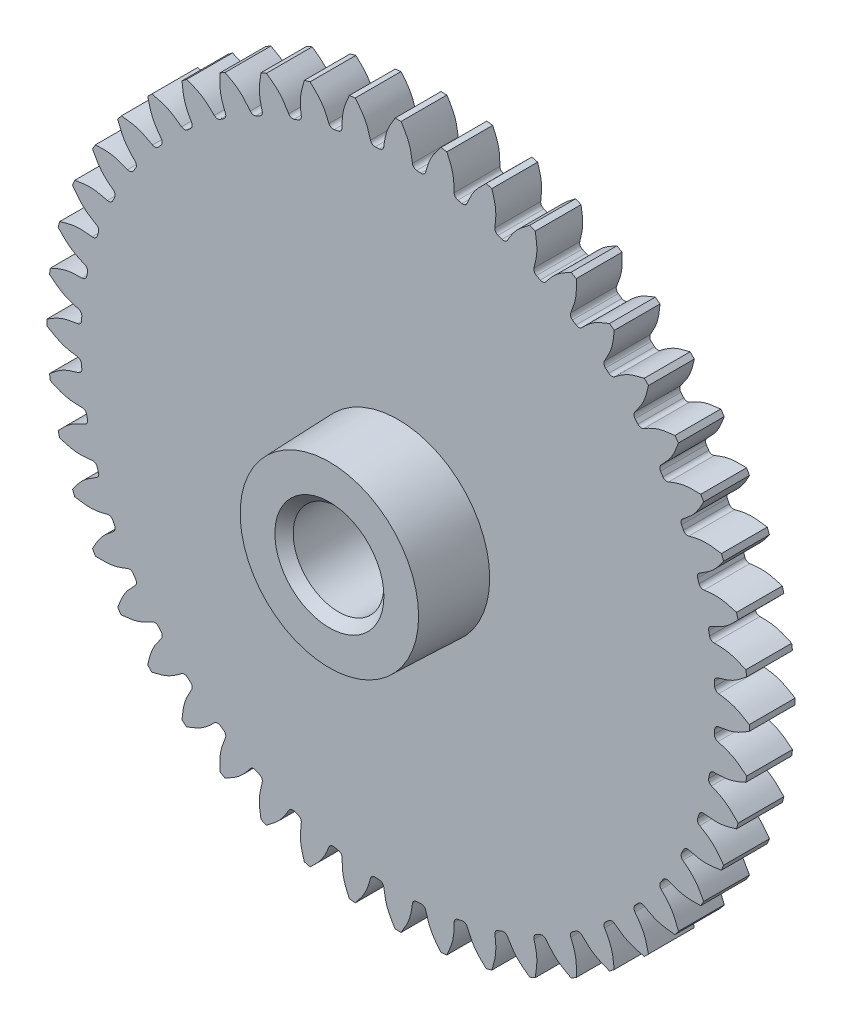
SolidWorks part; units mm, degrees
ref_plane "Face" through (0, 0, 0) normal (0, 0, 1) x (1, 0, 0)
ref_plane "Dessus" through (0, 0, 0) normal (0, 1, 0) x (1, 0, 0)
ref_plane "Droite" through (0, 0, 0) normal (1, 0, 0) x (0, 0, -1)
sketch "Esquisse1" plane through (0, 0, 0) normal (0, 0, 1) x (1, 0, 0)
  line L0 (0, 12.1501) -> (0, -6.105) construction
  line L1 (0.72, 12.0433) -> (0.72, 10.002) construction
  line L2 (0.36, 11.5985) -> (0.36, 10.9941) construction
  line L3 (-0.9735, 14.6577) -> (0.8316, 9.6984) construction
  line L4 (0, 11.5) -> (0.8727, 11.5) construction
  line L5 (0.0972, 11.5) -> (-0.0972, 11.5)
  line L6 (1.5974, 11.3889) -> (1.4047, 11.4143)
  line L7 (1.9563, 10.1988) -> (2.0955, 10.1711)
  line L8 (0.6084, 10.3669) -> (0.75, 10.3576)
  line L9 (3.0703, 11.083) -> (2.8825, 11.1333)
  line L10 (3.2708, 9.8562) -> (3.4052, 9.8106)
  line L11 (4.4907, 10.5874) -> (4.311, 10.6618)
  line L12 (4.5293, 9.3449) -> (4.6566, 9.2822)
  line L13 (5.8342, 9.9107) -> (5.6658, 10.0079)
  line L14 (5.7103, 8.6738) -> (5.8283, 8.5949)
  line L15 (7.0779, 9.0644) -> (6.9236, 9.1827)
  line L16 (6.7936, 7.8542) -> (6.9003, 7.7607)
  line L17 (8.2005, 8.063) -> (8.063, 8.2005)
  line L18 (7.7607, 6.9003) -> (7.8542, 6.7936)
  line L19 (9.1827, 6.9236) -> (9.0644, 7.0779)
  line L20 (8.5949, 5.8283) -> (8.6738, 5.7103)
  line L21 (10.0079, 5.6658) -> (9.9107, 5.8342)
  line L22 (9.2822, 4.6566) -> (9.3449, 4.5293)
  line L23 (10.6618, 4.311) -> (10.5874, 4.4907)
  line L24 (9.8106, 3.4052) -> (9.8562, 3.2708)
  line L25 (11.1333, 2.8825) -> (11.083, 3.0703)
  line L26 (10.1711, 2.0955) -> (10.1988, 1.9563)
  line L27 (11.4143, 1.4047) -> (11.3889, 1.5974)
  line L28 (10.3576, 0.75) -> (10.3669, 0.6084)
  line L29 (11.5, -0.0972) -> (11.5, 0.0972)
  line L30 (10.3669, -0.6084) -> (10.3576, -0.75)
  line L31 (11.3889, -1.5974) -> (11.4143, -1.4047)
  line L32 (10.1988, -1.9563) -> (10.1711, -2.0955)
  line L33 (11.083, -3.0703) -> (11.1333, -2.8825)
  line L34 (9.8562, -3.2708) -> (9.8106, -3.4052)
  line L35 (10.5874, -4.4907) -> (10.6618, -4.311)
  line L36 (9.3449, -4.5293) -> (9.2822, -4.6566)
  line L37 (9.9107, -5.8342) -> (10.0079, -5.6658)
  line L38 (8.6738, -5.7103) -> (8.5949, -5.8283)
  line L39 (9.0644, -7.0779) -> (9.1827, -6.9236)
  line L40 (7.8542, -6.7936) -> (7.7607, -6.9003)
  line L41 (8.063, -8.2005) -> (8.2005, -8.063)
  line L42 (6.9003, -7.7607) -> (6.7936, -7.8542)
  line L43 (6.9236, -9.1827) -> (7.0779, -9.0644)
  line L44 (5.8283, -8.5949) -> (5.7103, -8.6738)
  line L45 (5.6658, -10.0079) -> (5.8342, -9.9107)
  line L46 (4.6566, -9.2822) -> (4.5293, -9.3449)
  line L47 (4.311, -10.6618) -> (4.4907, -10.5874)
  line L48 (3.4052, -9.8106) -> (3.2708, -9.8562)
  line L49 (2.8825, -11.1333) -> (3.0703, -11.083)
  line L50 (2.0955, -10.1711) -> (1.9563, -10.1988)
  line L51 (1.4047, -11.4143) -> (1.5974, -11.3889)
  line L52 (0.75, -10.3576) -> (0.6084, -10.3669)
  line L53 (-0.0972, -11.5) -> (0.0972, -11.5)
  line L54 (-0.6084, -10.3669) -> (-0.75, -10.3576)
  line L55 (-1.5974, -11.3889) -> (-1.4047, -11.4143)
  line L56 (-1.9563, -10.1988) -> (-2.0955, -10.1711)
  line L57 (-3.0703, -11.083) -> (-2.8825, -11.1333)
  line L58 (-3.2708, -9.8562) -> (-3.4052, -9.8106)
  line L59 (-4.4907, -10.5874) -> (-4.311, -10.6618)
  line L60 (-4.5293, -9.3449) -> (-4.6566, -9.2822)
  line L61 (-5.8342, -9.9107) -> (-5.6658, -10.0079)
  line L62 (-5.7103, -8.6738) -> (-5.8283, -8.5949)
  line L63 (-7.0779, -9.0644) -> (-6.9236, -9.1827)
  line L64 (-6.7936, -7.8542) -> (-6.9003, -7.7607)
  line L65 (-8.2005, -8.063) -> (-8.063, -8.2005)
  line L66 (-7.7607, -6.9003) -> (-7.8542, -6.7936)
  line L67 (-9.1827, -6.9236) -> (-9.0644, -7.0779)
  line L68 (-8.5949, -5.8283) -> (-8.6738, -5.7103)
  line L69 (-10.0079, -5.6658) -> (-9.9107, -5.8342)
  line L70 (-9.2822, -4.6566) -> (-9.3449, -4.5293)
  line L71 (-10.6618, -4.311) -> (-10.5874, -4.4907)
  line L72 (-9.8106, -3.4052) -> (-9.8562, -3.2708)
  line L73 (-11.1333, -2.8825) -> (-11.083, -3.0703)
  line L74 (-10.1711, -2.0955) -> (-10.1988, -1.9563)
  line L75 (-11.4143, -1.4047) -> (-11.3889, -1.5974)
  line L76 (-10.3576, -0.75) -> (-10.3669, -0.6084)
  line L77 (-11.5, 0.0972) -> (-11.5, -0.0972)
  line L78 (-10.3669, 0.6084) -> (-10.3576, 0.75)
  line L79 (-11.3889, 1.5974) -> (-11.4143, 1.4047)
  line L80 (-10.1988, 1.9563) -> (-10.1711, 2.0955)
  line L81 (-11.083, 3.0703) -> (-11.1333, 2.8825)
  line L82 (-9.8562, 3.2708) -> (-9.8106, 3.4052)
  line L83 (-10.5874, 4.4907) -> (-10.6618, 4.311)
  line L84 (-9.3449, 4.5293) -> (-9.2822, 4.6566)
  line L85 (-9.9107, 5.8342) -> (-10.0079, 5.6658)
  line L86 (-8.6738, 5.7103) -> (-8.5949, 5.8283)
  line L87 (-9.0644, 7.0779) -> (-9.1827, 6.9236)
  line L88 (-7.8542, 6.7936) -> (-7.7607, 6.9003)
  line L89 (-8.063, 8.2005) -> (-8.2005, 8.063)
  line L90 (-6.9003, 7.7607) -> (-6.7936, 7.8542)
  line L91 (-6.9236, 9.1827) -> (-7.0779, 9.0644)
  line L92 (-5.8283, 8.5949) -> (-5.7103, 8.6738)
  line L93 (-5.6658, 10.0079) -> (-5.8342, 9.9107)
  line L94 (-4.6566, 9.2822) -> (-4.5293, 9.3449)
  line L95 (-4.311, 10.6618) -> (-4.4907, 10.5874)
  line L96 (-3.4052, 9.8106) -> (-3.2708, 9.8562)
  line L97 (-2.8825, 11.1333) -> (-3.0703, 11.083)
  line L98 (-2.0955, 10.1711) -> (-1.9563, 10.1988)
  line L99 (-1.4047, 11.4143) -> (-1.5974, 11.3889)
  line L100 (-0.75, 10.3576) -> (-0.6084, 10.3669)
  circle A0 centre (0, 0) radius 10.375 construction
  circle A1 centre (0, 0) radius 11 construction
  circle A2 centre (0, 0) radius 11.5 construction
  circle A3 centre (0, 0) radius 10.5 construction
  circle A4 centre (0, 0) radius 11.625 construction
  arc A5 (0.6084, 10.3669) -> (0.4694, 10.4975) centre (0.6182, 10.5166) cw
  arc A6 (0.75, 10.3576) -> (0.9048, 10.469) centre (0.7598, 10.5073) ccw
  arc A7 (-0.6084, 10.3669) -> (-0.4694, 10.4975) centre (-0.6182, 10.5166) ccw
  arc A8 (-0.75, 10.3576) -> (-0.9048, 10.469) centre (-0.7598, 10.5073) cw
  arc A9 (-1.8356, 10.3464) -> (-1.9563, 10.1988) centre (-1.9856, 10.3459) cw
  arc A10 (-2.0955, 10.1711) -> (-2.2636, 10.2613) centre (-2.1248, 10.3182) cw
  arc A11 (-3.1704, 10.0183) -> (-3.2708, 9.8562) centre (-3.319, 9.9982) cw
  arc A12 (-3.4052, 9.8106) -> (-3.5836, 9.8781) centre (-3.4534, 9.9526) cw
  arc A13 (-4.4509, 9.5188) -> (-4.5293, 9.3449) centre (-4.5956, 9.4795) cw
  arc A14 (-4.6566, 9.2822) -> (-4.8422, 9.3258) centre (-4.7229, 9.4167) cw
  arc A15 (-5.6553, 8.8564) -> (-5.7103, 8.6738) centre (-5.7936, 8.7985) cw
  arc A16 (-5.8283, 8.5949) -> (-6.0181, 8.614) centre (-5.9116, 8.7197) cw
  arc A17 (-6.7629, 8.0425) -> (-6.7936, 7.8542) centre (-6.8925, 7.967) cw
  arc A18 (-6.9003, 7.7607) -> (-7.0909, 7.7548) centre (-6.9992, 7.8734) cw
  arc A19 (-7.7548, 7.0909) -> (-7.7607, 6.9003) centre (-7.8734, 6.9992) cw
  arc A20 (-7.8542, 6.7936) -> (-8.0425, 6.7629) centre (-7.967, 6.8925) cw
  arc A21 (-8.614, 6.0181) -> (-8.5949, 5.8283) centre (-8.7197, 5.9116) cw
  arc A22 (-8.6738, 5.7103) -> (-8.8564, 5.6553) centre (-8.7985, 5.7936) cw
  arc A23 (-9.3258, 4.8422) -> (-9.2822, 4.6566) centre (-9.4167, 4.7229) cw
  arc A24 (-9.3449, 4.5293) -> (-9.5188, 4.4509) centre (-9.4795, 4.5956) cw
  arc A25 (-9.8781, 3.5836) -> (-9.8106, 3.4052) centre (-9.9526, 3.4534) cw
  arc A26 (-9.8562, 3.2708) -> (-10.0183, 3.1704) centre (-9.9982, 3.319) cw
  arc A27 (-10.2613, 2.2636) -> (-10.1711, 2.0955) centre (-10.3182, 2.1248) cw
  arc A28 (-10.1988, 1.9563) -> (-10.3464, 1.8356) centre (-10.3459, 1.9856) cw
  arc A29 (-10.469, 0.9048) -> (-10.3576, 0.75) centre (-10.5073, 0.7598) cw
  arc A30 (-10.3669, 0.6084) -> (-10.4975, 0.4694) centre (-10.5166, 0.6182) cw
  arc A31 (-10.4975, -0.4694) -> (-10.3669, -0.6084) centre (-10.5166, -0.6182) cw
  arc A32 (-10.3576, -0.75) -> (-10.469, -0.9048) centre (-10.5073, -0.7598) cw
  arc A33 (-10.3464, -1.8356) -> (-10.1988, -1.9563) centre (-10.3459, -1.9856) cw
  arc A34 (-10.1711, -2.0955) -> (-10.2613, -2.2636) centre (-10.3182, -2.1248) cw
  arc A35 (-10.0183, -3.1704) -> (-9.8562, -3.2708) centre (-9.9982, -3.319) cw
  arc A36 (-9.8106, -3.4052) -> (-9.8781, -3.5836) centre (-9.9526, -3.4534) cw
  arc A37 (-9.5188, -4.4509) -> (-9.3449, -4.5293) centre (-9.4795, -4.5956) cw
  arc A38 (-9.2822, -4.6566) -> (-9.3258, -4.8422) centre (-9.4167, -4.7229) cw
  arc A39 (-8.8564, -5.6553) -> (-8.6738, -5.7103) centre (-8.7985, -5.7936) cw
  arc A40 (-8.5949, -5.8283) -> (-8.614, -6.0181) centre (-8.7197, -5.9116) cw
  arc A41 (-8.0425, -6.7629) -> (-7.8542, -6.7936) centre (-7.967, -6.8925) cw
  arc A42 (-7.7607, -6.9003) -> (-7.7548, -7.0909) centre (-7.8734, -6.9992) cw
  arc A43 (-7.0909, -7.7548) -> (-6.9003, -7.7607) centre (-6.9992, -7.8734) cw
  arc A44 (-6.7936, -7.8542) -> (-6.7629, -8.0425) centre (-6.8925, -7.967) cw
  arc A45 (-6.0181, -8.614) -> (-5.8283, -8.5949) centre (-5.9116, -8.7197) cw
  arc A46 (-5.7103, -8.6738) -> (-5.6553, -8.8564) centre (-5.7936, -8.7985) cw
  arc A47 (-4.8422, -9.3258) -> (-4.6566, -9.2822) centre (-4.7229, -9.4167) cw
  arc A48 (-4.5293, -9.3449) -> (-4.4509, -9.5188) centre (-4.5956, -9.4795) cw
  arc A49 (-3.5836, -9.8781) -> (-3.4052, -9.8106) centre (-3.4534, -9.9526) cw
  arc A50 (-3.2708, -9.8562) -> (-3.1704, -10.0183) centre (-3.319, -9.9982) cw
  arc A51 (-2.2636, -10.2613) -> (-2.0955, -10.1711) centre (-2.1248, -10.3182) cw
  arc A52 (-1.9563, -10.1988) -> (-1.8356, -10.3464) centre (-1.9856, -10.3459) cw
  arc A53 (-0.9048, -10.469) -> (-0.75, -10.3576) centre (-0.7598, -10.5073) cw
  arc A54 (-0.6084, -10.3669) -> (-0.4694, -10.4975) centre (-0.6182, -10.5166) cw
  arc A55 (0.4694, -10.4975) -> (0.6084, -10.3669) centre (0.6182, -10.5166) cw
  arc A56 (0.75, -10.3576) -> (0.9048, -10.469) centre (0.7598, -10.5073) cw
  arc A57 (1.8356, -10.3464) -> (1.9563, -10.1988) centre (1.9856, -10.3459) cw
  arc A58 (2.0955, -10.1711) -> (2.2636, -10.2613) centre (2.1248, -10.3182) cw
  arc A59 (3.1704, -10.0183) -> (3.2708, -9.8562) centre (3.319, -9.9982) cw
  arc A60 (3.4052, -9.8106) -> (3.5836, -9.8781) centre (3.4534, -9.9526) cw
  arc A61 (4.4509, -9.5188) -> (4.5293, -9.3449) centre (4.5956, -9.4795) cw
  arc A62 (4.6566, -9.2822) -> (4.8422, -9.3258) centre (4.7229, -9.4167) cw
  arc A63 (5.6553, -8.8564) -> (5.7103, -8.6738) centre (5.7936, -8.7985) cw
  arc A64 (5.8283, -8.5949) -> (6.0181, -8.614) centre (5.9116, -8.7197) cw
  arc A65 (6.7629, -8.0425) -> (6.7936, -7.8542) centre (6.8925, -7.967) cw
  arc A66 (6.9003, -7.7607) -> (7.0909, -7.7548) centre (6.9992, -7.8734) cw
  arc A67 (7.7548, -7.0909) -> (7.7607, -6.9003) centre (7.8734, -6.9992) cw
  arc A68 (7.8542, -6.7936) -> (8.0425, -6.7629) centre (7.967, -6.8925) cw
  arc A69 (8.614, -6.0181) -> (8.5949, -5.8283) centre (8.7197, -5.9116) cw
  arc A70 (8.6738, -5.7103) -> (8.8564, -5.6553) centre (8.7985, -5.7936) cw
  arc A71 (9.3258, -4.8422) -> (9.2822, -4.6566) centre (9.4167, -4.7229) cw
  arc A72 (9.3449, -4.5293) -> (9.5188, -4.4509) centre (9.4795, -4.5956) cw
  arc A73 (9.8781, -3.5836) -> (9.8106, -3.4052) centre (9.9526, -3.4534) cw
  arc A74 (9.8562, -3.2708) -> (10.0183, -3.1704) centre (9.9982, -3.319) cw
  arc A75 (10.2613, -2.2636) -> (10.1711, -2.0955) centre (10.3182, -2.1248) cw
  arc A76 (10.1988, -1.9563) -> (10.3464, -1.8356) centre (10.3459, -1.9856) cw
  arc A77 (10.469, -0.9048) -> (10.3576, -0.75) centre (10.5073, -0.7598) cw
  arc A78 (10.3669, -0.6084) -> (10.4975, -0.4694) centre (10.5166, -0.6182) cw
  arc A79 (10.4975, 0.4694) -> (10.3669, 0.6084) centre (10.5166, 0.6182) cw
  arc A80 (10.3576, 0.75) -> (10.469, 0.9048) centre (10.5073, 0.7598) cw
  arc A81 (10.3464, 1.8356) -> (10.1988, 1.9563) centre (10.3459, 1.9856) cw
  arc A82 (10.1711, 2.0955) -> (10.2613, 2.2636) centre (10.3182, 2.1248) cw
  arc A83 (10.0183, 3.1704) -> (9.8562, 3.2708) centre (9.9982, 3.319) cw
  arc A84 (9.8106, 3.4052) -> (9.8781, 3.5836) centre (9.9526, 3.4534) cw
  arc A85 (9.5188, 4.4509) -> (9.3449, 4.5293) centre (9.4795, 4.5956) cw
  arc A86 (9.2822, 4.6566) -> (9.3258, 4.8422) centre (9.4167, 4.7229) cw
  arc A87 (8.8564, 5.6553) -> (8.6738, 5.7103) centre (8.7985, 5.7936) cw
  arc A88 (8.5949, 5.8283) -> (8.614, 6.0181) centre (8.7197, 5.9116) cw
  arc A89 (8.0425, 6.7629) -> (7.8542, 6.7936) centre (7.967, 6.8925) cw
  arc A90 (7.7607, 6.9003) -> (7.7548, 7.0909) centre (7.8734, 6.9992) cw
  arc A91 (7.0909, 7.7548) -> (6.9003, 7.7607) centre (6.9992, 7.8734) cw
  arc A92 (6.7936, 7.8542) -> (6.7629, 8.0425) centre (6.8925, 7.967) cw
  arc A93 (6.0181, 8.614) -> (5.8283, 8.5949) centre (5.9116, 8.7197) cw
  arc A94 (5.7103, 8.6738) -> (5.6553, 8.8564) centre (5.7936, 8.7985) cw
  arc A95 (4.8422, 9.3258) -> (4.6566, 9.2822) centre (4.7229, 9.4167) cw
  arc A96 (4.5293, 9.3449) -> (4.4509, 9.5188) centre (4.5956, 9.4795) cw
  arc A97 (3.5836, 9.8781) -> (3.4052, 9.8106) centre (3.4534, 9.9526) cw
  arc A98 (3.2708, 9.8562) -> (3.1704, 10.0183) centre (3.319, 9.9982) cw
  arc A99 (2.2636, 10.2613) -> (2.0955, 10.1711) centre (2.1248, 10.3182) cw
  arc A100 (1.9563, 10.1988) -> (1.8356, 10.3464) centre (1.9856, 10.3459) cw
  spline_without_curve S0
  spline_without_curve S1
  spline_without_curve S2
  spline_without_curve S3
  spline_without_curve S4
  spline_without_curve S5
  spline_without_curve S6
  spline_without_curve S7
  spline_without_curve S8
  spline_without_curve S9
  spline_without_curve S10
  spline_without_curve S11
  spline_without_curve S12
  spline_without_curve S13
  spline_without_curve S14
  spline_without_curve S15
  spline_without_curve S16
  spline_without_curve S17
  spline_without_curve S18
  spline_without_curve S19
  spline_without_curve S20
  spline_without_curve S21
  spline_without_curve S22
  spline_without_curve S23
  spline_without_curve S24
  spline_without_curve S25
  spline_without_curve S26
  spline_without_curve S27
  spline_without_curve S28
  spline_without_curve S29
  spline_without_curve S30
  spline_without_curve S31
  spline_without_curve S32
  spline_without_curve S33
  spline_without_curve S34
  spline_without_curve S35
  spline_without_curve S36
  spline_without_curve S37
  spline_without_curve S38
  spline_without_curve S39
  spline_without_curve S40
  spline_without_curve S41
  spline_without_curve S42
  spline_without_curve S43
  spline_without_curve S44
  spline_without_curve S45
  spline_without_curve S46
  spline_without_curve S47
  spline_without_curve S48
  spline_without_curve S49
  spline_without_curve S50
  spline_without_curve S51
  spline_without_curve S52
  spline_without_curve S53
  spline_without_curve S54
  spline_without_curve S55
  spline_without_curve S56
  spline_without_curve S57
  spline_without_curve S58
  spline_without_curve S59
  spline_without_curve S60
  spline_without_curve S61
  spline_without_curve S62
  spline_without_curve S63
  spline_without_curve S64
  spline_without_curve S65
  spline_without_curve S66
  spline_without_curve S67
  spline_without_curve S68
  spline_without_curve S69
  spline_without_curve S70
  spline_without_curve S71
  spline_without_curve S72
  spline_without_curve S73
  spline_without_curve S74
  spline_without_curve S75
  spline_without_curve S76
  spline_without_curve S77
  spline_without_curve S78
  spline_without_curve S79
  spline_without_curve S80
  spline_without_curve S81
  spline_without_curve S82
  spline_without_curve S83
  spline_without_curve S84
  spline_without_curve S85
  spline_without_curve S86
  spline_without_curve S87
  spline_without_curve S88
  spline_without_curve S89
  spline_without_curve S90
  spline_without_curve S91
  spline_without_curve S92
  spline_without_curve S93
  spline_without_curve S94
  spline_without_curve S95
  dimension "D1" = 20
  dimension "D2" = 0.15
  dimension "D3" = 0.15
  dimension "D4" = 0.15
  dimension "D5" = 0.15
  dimension "D6" = 0.15
  dimension "D7" = 0.15
extrude "Base-Extrusion" add sketch "Esquisse1" along normal mid plane 1.5
sketch "Esquisse2" plane through (0, 0, 0) normal (0, 0, 1) x (1, 0, 0)
  circle A0 centre (0, 0) radius 3
extrude "Boss.-Extru.1" add sketch "Esquisse2" along normal mid plane 6
sketch "Esquisse3" plane through (0, 0, 0) normal (0, 0, 1) x (1, 0, 0)
  circle A0 centre (0, 0) radius 1.485
extrude "Enlèv. mat.-Extru.1" cut sketch "Esquisse3" against normal mid plane 10
chamfer "Chanfrein1" distance 0.3 angle 45
draft "Dépouille1" type of draft neutral plane draft angle 2 faces to draft 1 parameters "D1"=2
draft "Dépouille2" type of draft neutral plane draft angle 2 faces to draft 1 parameters "D1"=2
